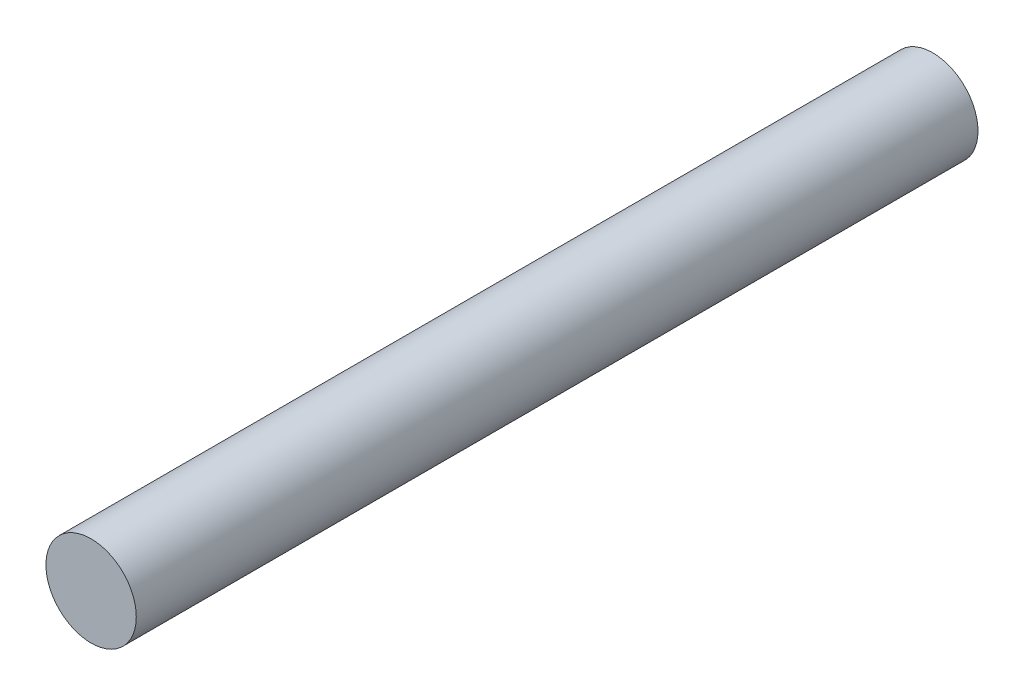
SolidWorks part; units mm, degrees
ref_plane "Front Plane" through (0, 0, 0) normal (0, 0, 1) x (1, 0, 0)
ref_plane "Top Plane" through (0, 0, 0) normal (0, 1, 0) x (1, 0, 0)
ref_plane "Right Plane" through (0, 0, 0) normal (1, 0, 0) x (0, 0, -1)
sketch "Sketch1" plane through (0, 0, 0) normal (0, 0, 1) x (1, 0, 0)
  circle A0 centre (0, 0) radius 0.6477
extrude "Boss-Extrude1" add sketch "Sketch1" along normal blind 12.065
